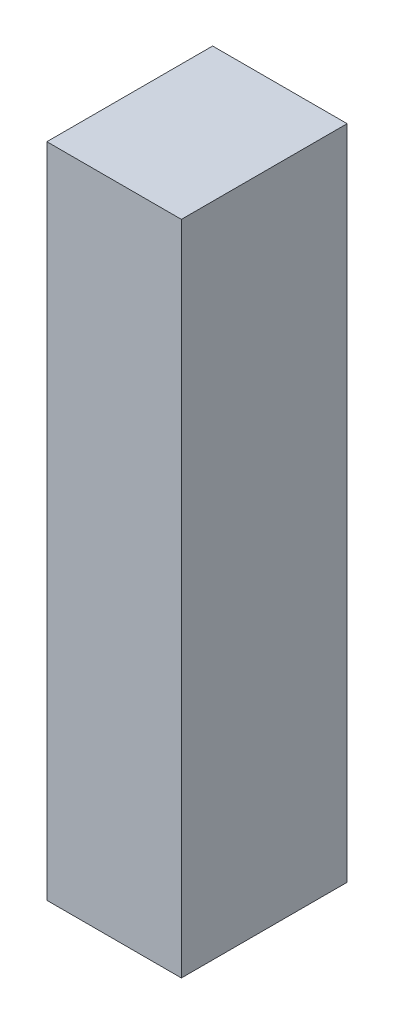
SolidWorks part; units mm, degrees
ref_plane "Front" through (0, 0, 0) normal (0, 0, 1) x (1, 0, 0)
ref_plane "Top" through (0, 0, 0) normal (0, 1, 0) x (1, 0, 0)
ref_plane "Right" through (0, 0, 0) normal (1, 0, 0) x (0, 0, -1)
sketch "Sketch1" plane through (0, 0, 0) normal (0, 1, 0) x (1, 0, 0)
  line L1 (72, -69) -> (-72, -69)
  line L2 (72, -69) -> (72, 69)
  line L3 (72, 69) -> (-72, 69)
  line L4 (-72, -69) -> (-72, 69)
  line L5 (72, -69) -> (-72, 69) construction
  line L6 (72, 69) -> (-72, -69) construction
  point P0 (0, 0)
  dimension "D1" = 144
  dimension "D2" = 138
extrude "Boss-Extrude1" add sketch "Sketch1" along normal blind 547
sketch "FORCE POSITION" plane through (-72, 0, 0) normal (-1, 0, 0) x (0, 0, 1)
  line L0 (0, 0) -> (0, 230) construction
  point P4 (0, 230)
  dimension "D1" = 230
